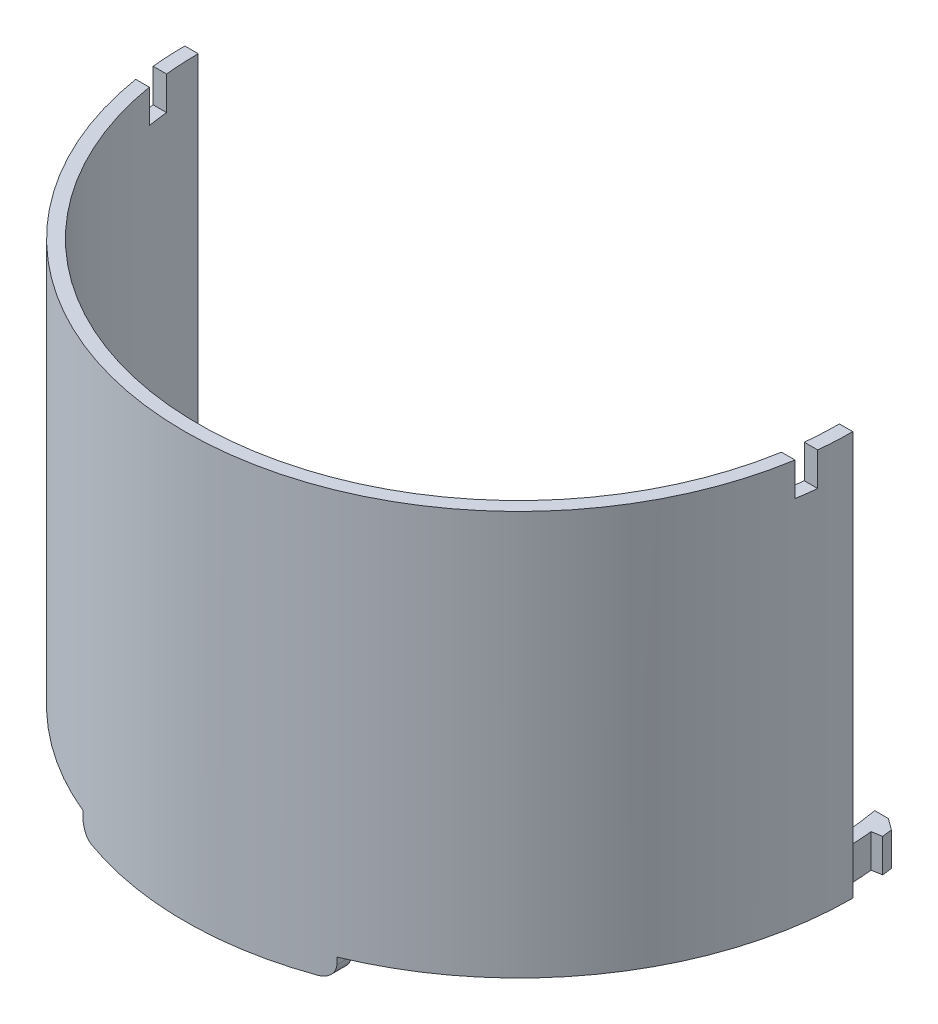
SolidWorks part; units mm, degrees
ref_plane "Front Plane" through (0, 0, 0) normal (0, 0, 1) x (1, 0, 0)
ref_plane "Top Plane" through (0, 0, 0) normal (0, 1, 0) x (1, 0, 0)
ref_plane "Right Plane" through (0, 0, 0) normal (1, 0, 0) x (0, 0, -1)
sketch "Sketch1" plane through (0, 0, 0) normal (0, 1, 0) x (1, 0, 0)
  line L0 (-50, 0) -> (-48, 0)
  line L1 (48, 0) -> (50, 0)
  arc A0 (-50, 0) -> (50, 0) centre (0, 0) ccw
  arc A1 (-48, 0) -> (48, 0) centre (0, 0) ccw
  dimension "D1" = 100
  dimension "D2" = 2
extrude "Shell Body" add sketch "Sketch1" along normal blind 60.5
sketch "Sketch2" plane through (0, 0, 0) normal (0, -1, 0) x (1, 0, 0)
  line L0 (0, 50) -> (0, 0) construction
  line L1 (-50, 0) -> (0, 0) construction
  line L2 (19, 44.0795) -> (19, 46.2493)
  line L3 (-19, 44.0795) -> (-19, 46.2493)
  arc A0 (50, 0) -> (-50, 0) centre (0, 0) ccw construction
  arc A1 (48, 0) -> (-48, 0) centre (0, 0) ccw construction
  arc A2 (19, 46.2493) -> (-19, 46.2493) centre (0, 0) ccw
  arc A3 (19, 44.0795) -> (-19, 44.0795) centre (0, 0) ccw
  dimension "D1" = 38
sketch "Sketch3" plane through (0, 60.5, 0) normal (0, 1, 0) x (1, 0, 0)
  line L0 (0, 0) -> (0, -50) construction
  line L1 (-50, 0) -> (0, 0) construction
  line L2 (47.3286, -5) -> (47.3286, -8)
  line L3 (-49.7494, -5) -> (-47.3286, -5)
  line L4 (-49.7494, -5) -> (-49.7494, -8)
  line L5 (-49.7494, -8) -> (-47.3286, -8)
  line L6 (-47.3286, -5) -> (-47.3286, -8)
  line L7 (49.7494, -8) -> (47.3286, -8)
  line L8 (49.7494, -5) -> (49.7494, -8)
  line L9 (49.7494, -5) -> (47.3286, -5)
  arc A0 (-50, 0) -> (50, 0) centre (0, 0) ccw construction
  arc A1 (-48, 0) -> (48, 0) centre (0, 0) ccw construction
  dimension "D1" = 3
  dimension "D2" = 5
extrude "Clip Cavity" cut sketch "Sketch3" against normal blind 5
sketch "Sketch4" plane through (0, 0, 0) normal (0, -1, 0) x (1, 0, 0)
  line L0 (0, 0) -> (0, 27.6192) construction
  line L1 (0, 0) -> (48, 0) construction
  line L2 (47.7389, -5) -> (0, 0) construction
  line L3 (47.9062, 3) -> (0, 0) construction
  line L4 (45.299, -8) -> (47.3286, -8)
  line L5 (47.3286, -8) -> (49.0376, -6.75)
  line L6 (49.0376, -6.75) -> (49.2196, -5.2611)
  line L7 (49.2196, -5.2611) -> (47.7389, -5)
  line L8 (47.9062, 3) -> (45.9101, 2.875)
  line L9 (50, 0) -> (48, 0) construction
  line L10 (-47.9062, 3) -> (-45.9101, 2.875)
  line L11 (-45.299, -8) -> (-47.3286, -8)
  line L12 (-47.3286, -8) -> (-49.0376, -6.75)
  line L13 (-49.2196, -5.2611) -> (-47.7389, -5)
  line L14 (-49.0376, -6.75) -> (-49.2196, -5.2611)
  arc A0 (47.9062, 3) -> (47.7389, -5) centre (0, 0) cw
  arc A1 (48, 0) -> (-48, 0) centre (0, 0) ccw construction
  arc A2 (45.9101, 2.875) -> (45.7498, -4.7917) centre (0, 0) cw
  arc A3 (45.7498, -4.7917) -> (45.299, -8) centre (0, 0) cw
  arc A4 (47.7389, -5) -> (43.7237, -19.8049) centre (0, 0) cw construction
  arc A5 (49.5, 0) -> (45.2081, -20.1614) centre (0, 0) cw construction
  arc A6 (-45.9101, 2.875) -> (-45.7498, -4.7917) centre (0, 0) ccw
  arc A7 (-47.9062, 3) -> (-47.7389, -5) centre (0, 0) ccw
  arc A8 (-45.7498, -4.7917) -> (-45.299, -8) centre (0, 0) ccw
  dimension "D1" = 2
  dimension "D4" = 3
  dimension "D5" = 1.5
  dimension "D2" = 3
  dimension "D3" = 5
  dimension "D6" = 1.5
  dimension "D7" = 1.25
extrude "Clip" add sketch "Sketch4" against normal blind 5
extrude "Shell Insert" add sketch "Sketch2" along normal blind 3
fillet "Shell Fillet" radius 2 4 edges at (47.9062, 2.5, 3) (-47.9062, 2.5, 3) (19, -3, 45.1644) (-19, -3, 45.1644)
ref_point "Ref Center"
equation "\"D1@Sketch1\"=\"base diameter@values@params.sldprt\""
